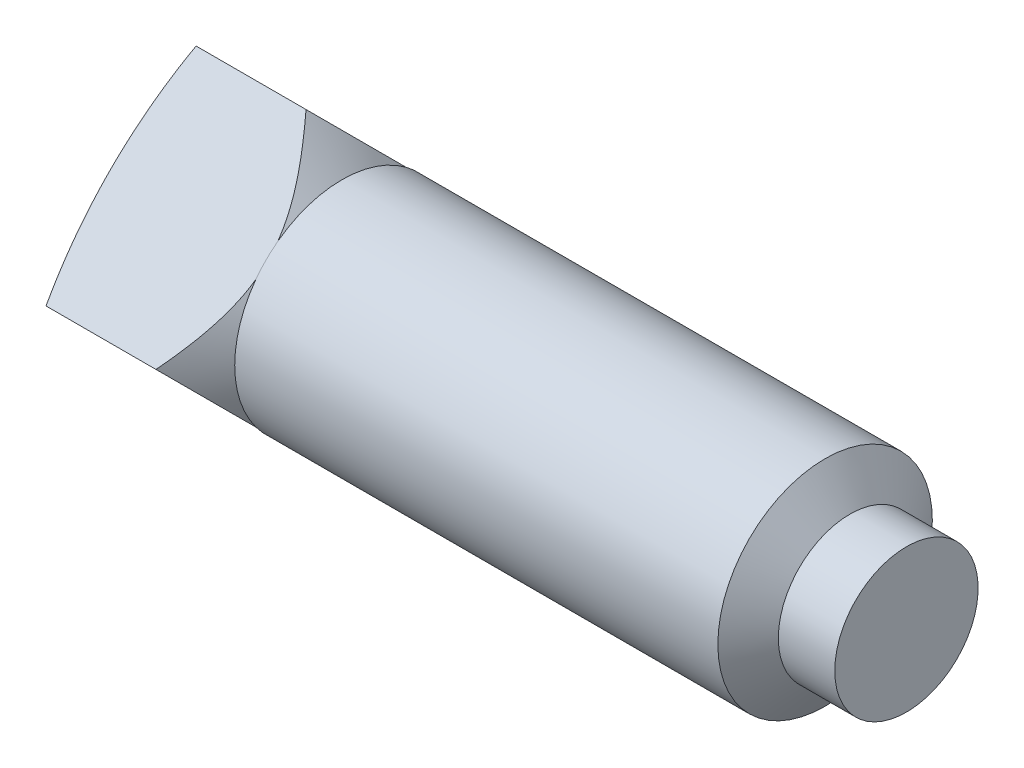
SolidWorks part; units mm, degrees
ref_plane "Plane1" through (0, 0, 0) normal (0, 0, 1) x (1, 0, 0)
ref_plane "Plane2" through (0, 0, 0) normal (0, 1, 0) x (1, 0, 0)
ref_plane "Plane3" through (0, 0, 0) normal (1, 0, 0) x (0, 0, -1)
sketch "BodySke" plane through (0, 0, 0) normal (0, 0, 1) x (1, 0, 0)
  line L0 (11.43, -1.6129) -> (12.7, -1.6129) construction
  line L1 (0, 0) -> (0, 2.413)
  line L2 (0, 2.413) -> (10.8698, 2.413)
  line L3 (12.7, 1.6129) -> (12.7, 0)
  line L4 (12.7, 0) -> (0, 0)
  line L5 (0, 0) -> (34.4106, 0) construction
  line L6 (0.7874, 3.175) -> (0.7874, -1.6129) construction
  line L7 (11.43, 1.6129) -> (12.7, 1.6129)
  line L8 (0, -2.413) -> (10.287, -2.413) construction
  line L9 (11.43, 1.6129) -> (10.8698, 2.413)
  line L10 (-1.27, 3.175) -> (-1.27, -1.6129) construction
  dimension "D1" = 125
  dimension "Length" = 12.7
  dimension "Diameter" = 4.826
  dimension "Dog_dia" = 3.2258
  dimension "Dog_len" = 1.27
  dimension "Advance" = 0.7874
  dimension "Thread_nom" = 12.7
revolve "BaseBody" add sketch "BodySke"
pattern_linear "ThdSchPat" [suppressed]
revolve "ThreadSchematic" cut sketch "ThdSchSke" angle 360 about L5
sketch "ThdSchSke" plane through (0, 0, 0) normal (0, 0, 1) x (1, 0, 0)
  line L0 (0.7874, -1.9406) -> (0.4566, -2.413)
  line L1 (0.7874, -1.9406) -> (1.1182, -2.413)
  line L2 (1.1182, -2.413) -> (1.1182, -3.0162)
  line L3 (-3.175, 0) -> (5.1513, 0) construction
  line L5 (1.1182, -3.0162) -> (0.4566, -3.0163)
  line L6 (0.4566, -3.0163) -> (0.4566, -2.413)
  dimension "D1" = 360
  dimension "Thread_minor" = 3.8811
  dimension "D2" = 1
  dimension "Diameter" = 4.826
  dimension "Start" = 0.7874
  dimension "D4" = 50
  dimension "SideAngle" = 55
  dimension "VeeAngle" = 70
  dimension "Overcut" = 6.0325
  dimension "Num_threads" = 14
  dimension "Advance" = 0.7602
  dimension "Thread_length" = 10.6426
sketch "Sketch4" plane through (0, 0, 0) normal (-1, 0, 0) x (0, -0.7071, 0.7071)
  line L1 (-2.3876, -2.3876) -> (2.3876, -2.3876)
  line L2 (-2.3876, -2.3876) -> (-2.3876, 2.3876)
  line L3 (-2.3876, 2.3876) -> (2.3876, 2.3876)
  line L4 (2.3876, -2.3876) -> (2.3876, 2.3876)
  dimension "D1" = 4.7752
  dimension "Width_flats" = 4.7752
  dimension "D2" = 2.3876
  dimension "D3" = 2.3876
extrude "BaseHead" add sketch "Sketch4" along normal blind 3.7592
sketch "Sketch5" plane through (0, 0, 0) normal (0, 0, 1) x (1, 0, 0)
  line L0 (-3.7592, 0) -> (-16.4592, 0)
  line L1 (0, 0) -> (57.15, 0) construction
  line L2 (0, 0) -> (34.4106, 0) construction
  line L3 (-16.4592, 0) -> (-16.4592, 3.3766)
  line L5 (-16.4592, 3.3766) -> (-3.2823, 3.3766)
  line L6 (-3.7592, 3.3766) -> (0, 3.3766) construction
  arc A0 (-3.2823, 3.3766) -> (-3.7592, 0) centre (8.4328, 0) ccw
  dimension "Head_radius" = 12.192
  dimension "D2" = 8.4328
  dimension "D3" = 12.7
revolve "HeadCrown" cut sketch "Sketch5" angle 360 about L1
sketch "Sketch6" plane through (0, 0, 0) normal (0, 0, 1) x (1, 0, 0)
  line L0 (0, 2.413) -> (-0.8085, 3.3766)
  line L1 (12.7, 2.413) -> (0, 2.413)
  line L3 (0, 1.9352) -> (0, 3.3766) construction
  line L4 (-3.2823, 3.3766) -> (0, 3.3766) construction
  line L5 (-0.8085, 3.3766) -> (-0.8085, 16.0766)
  line L7 (12.7, 2.413) -> (12.7, 16.0766)
  line L8 (12.7, 16.0766) -> (-0.8085, 16.0766)
  line L9 (0, 0) -> (60.325, 0) construction
  dimension "D1" = 40
  dimension "D2" = 12.7
  dimension "D3" = 12.7
  dimension "D4" = 2.413
revolve "HeadChamfer1" cut sketch "Sketch6" angle 360 about L9
equation "\"D1@Sketch4\" = \"Width_flats@Sketch4\""
equation "\"D2@Sketch4\" = \"Width_flats@Sketch4\" / 2"
equation "\"D3@Sketch4\" = \"Width_flats@Sketch4\" / 2"
equation "\"D2@Sketch5\" = \"Head_radius@Sketch5\" - \"Head_ht@BaseHead\""
equation "\"Thread_length@ThreadCosmetic\" = ((sgn( (\"Length@BodySke\" - \"Advance@BodySke\" - \"Dog_len@BodySke\" ) - \"Thread_nom@BodySke\" )-1)*( (\"Length@BodySke\" - \"Advance@BodySke\" - \"Dog_len@BodySke\" ) - \"Thread_"
equation "\"Thread_minor@ThdSchSke\" = \"Thread_minor@ThreadCosmetic\""
equation "\"Diameter@ThdSchSke\" = \"Diameter@BodySke\""
equation "\"Overcut@ThdSchSke\" = \"Diameter@BodySke\" * 1.25"
equation "\"Start@ThdSchSke\" = (\"Length@BodySke\" - \"Dog_len@BodySke\" ) - \"Thread_length@ThreadCosmetic\"  '---Non-countersunk---"
equation "\"Num_threads@ThdSchPat\" = int( \"Thread_length@ThreadCosmetic\" / \"Advance@BodySke\" + 0.999 )  + 1"
equation "\"Advance@ThdSchPat\" = \"Thread_length@ThreadCosmetic\" /  (\"Num_threads@ThdSchPat\" - 1) 'relax it"
equation "\"Num_threads@ThdSchPat\" = \"Num_threads@ThdSchPat\" - sgn( \"Num_threads@ThdSchPat\" - 1) '---chamfered tips only---"
equation "\"D4@Sketch6\" = \"Diameter@BodySke\" / 2.0"
